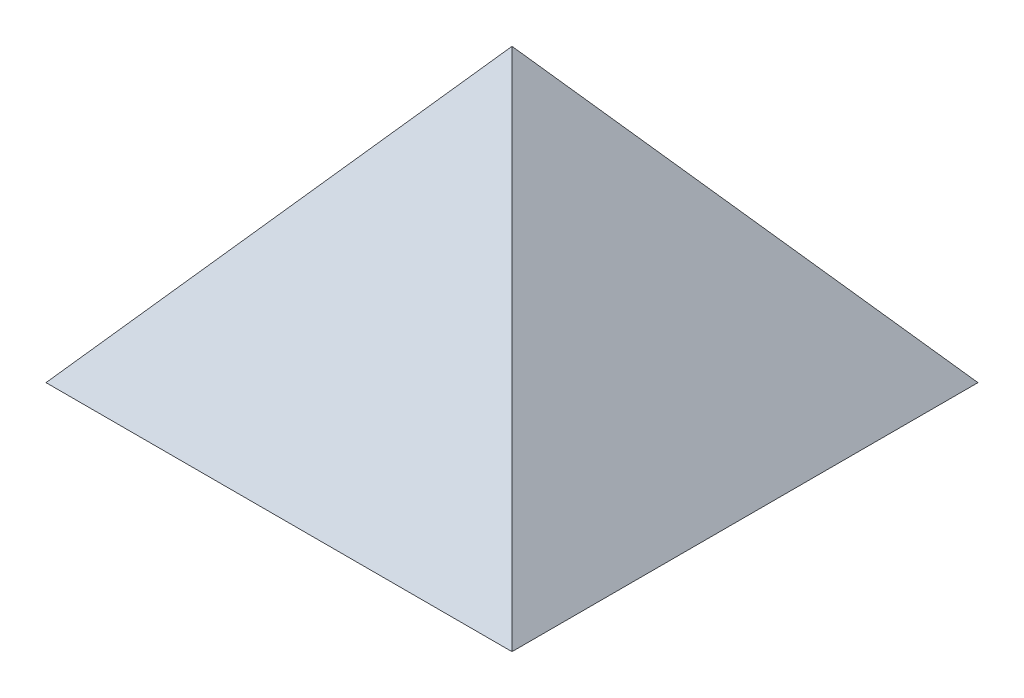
SolidWorks part; units mm, degrees
ref_plane "正面" through (0, 0, 0) normal (0, 0, 1) x (1, 0, 0)
ref_plane "平面" through (0, 0, 0) normal (0, 1, 0) x (1, 0, 0)
ref_plane "右側面" through (0, 0, 0) normal (1, 0, 0) x (0, 0, -1)
sketch "ｽｹｯﾁ1" plane through (0, 0, 0) normal (0, 1, 0) x (1, 0, 0)
  line L0 (40, 40) -> (-40, -40) construction
  line L1 (-40, -40) -> (40, -40)
  line L2 (-40, -40) -> (-40, 40)
  line L3 (-40, 40) -> (40, 40)
  line L4 (40, -40) -> (40, 40)
  dimension "D1" = 80
  dimension "D2" = 80
ref_plane "平面1" through (0, 50, 0) normal (0, 1, 0) x (-1, 0, 0)
sketch "ｽｹｯﾁ2" plane through (0, 50, 0) normal (0, 1, 0) x (-1, 0, 0)
  point P0 (0, 0)
loft "ﾛﾌﾄ1" add profiles "ｽｹｯﾁ1", "ｽｹｯﾁ2"
